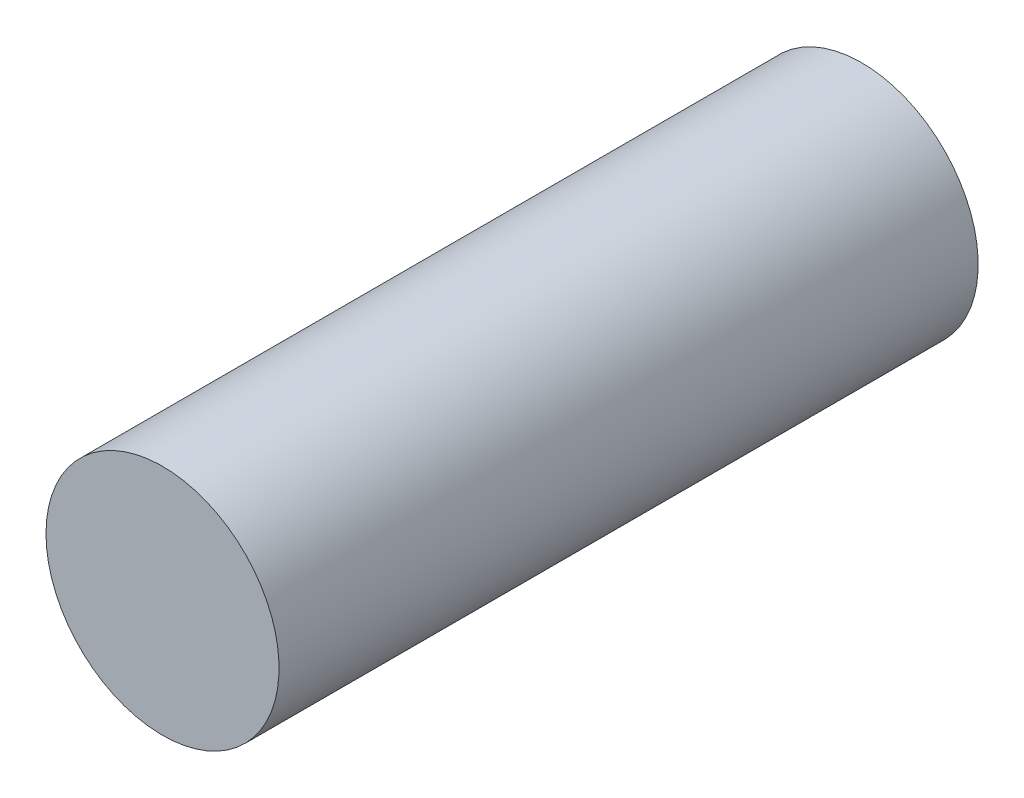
SolidWorks part; units mm, degrees
ref_plane "Front Plane" through (0, 0, 0) normal (0, 0, 1) x (1, 0, 0)
ref_plane "Top Plane" through (0, 0, 0) normal (0, 1, 0) x (1, 0, 0)
ref_plane "Right Plane" through (0, 0, 0) normal (1, 0, 0) x (0, 0, -1)
sketch "Sketch1" plane through (0, 0, 0) normal (0, 0, 1) x (1, 0, 0)
  circle A0 centre (0, 0) radius 6.35
  dimension "D1" = 12.7
extrude "Boss-Extrude1" add sketch "Sketch1" along normal blind 38.1
